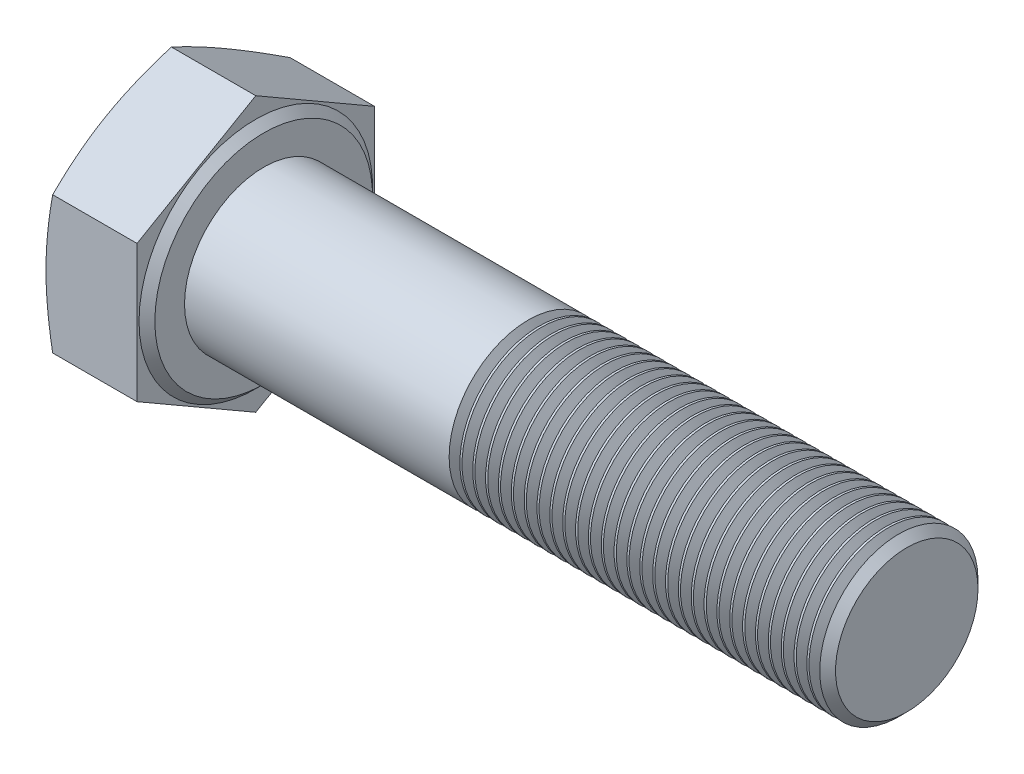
SolidWorks part; units mm, degrees
ref_plane "Front" through (0, 0, 0) normal (0, 0, 1) x (1, 0, 0)
ref_plane "Top" through (0, 0, 0) normal (0, 1, 0) x (1, 0, 0)
ref_plane "Right" through (0, 0, 0) normal (1, 0, 0) x (0, 0, -1)
other "Configuration Table"
sketch "Sketch2" plane through (0, 0, 0) normal (1, 0, 0) x (0, 0, -1)
  line L1 (0, -13.8564) -> (12, -6.9282)
  line L2 (12, -6.9282) -> (12, 6.9282)
  line L3 (12, 6.9282) -> (0, 13.8564)
  line L4 (0, 13.8564) -> (-12, 6.9282)
  line L5 (-12, 6.9282) -> (-12, -6.9282)
  line L6 (-12, -6.9282) -> (0, -13.8564)
  circle A0 centre (0, 0) radius 12 construction
extrude "BaseHead" add sketch "Sketch2" along normal blind 10
sketch "Sketch3" plane through (0, 0, 0) normal (0, 0, 1) x (1, 0, 0)
  line L0 (10, 13.8564) -> (10, 11)
  line L2 (10, 11) -> (9.2, 11.8)
  line L3 (9.2, 11.8) -> (9.2, 13.8564)
  line L5 (9.2, 13.8564) -> (10, 13.8564)
  line L6 (-0.9571, 0) -> (7.6478, 0) construction
  line L7 (10, 13.8564) -> (0, 13.8564) construction
  dimension "D1" = 45
  dimension "c" = 0.8
  dimension "dw" = 22
revolve "BearingFace" cut sketch "Sketch3" angle 360 about L6
sketch "Sketch4" plane through (0, 0, 0) normal (0, 0, 1) x (1, 0, 0)
  line L0 (-0.4935, 0) -> (3.5626, 0) construction
  line L2 (0, 13.8564) -> (0.6757, 13.8564)
  line L4 (0.6757, 13.8564) -> (0, 12)
  line L6 (0, 12) -> (0, 13.8564)
  line L7 (9.2, 13.8564) -> (0, 13.8564) construction
revolve "HeadChamfer" cut sketch "Sketch4" angle 360 about L0
ref_plane "Plane1" through (37, 0, 0) normal (1, 0, 0) x (0, 0, -1)
sketch "Sketch5" plane through (10, 0, 0) normal (1, 0, 0) x (0, 0, -1)
  circle A0 centre (0, 0) radius 8
extrude "BaseBody" add sketch "Sketch5" along normal blind 65
chamfer "Chamfer1" distance 0.8 angle 45 1 edges at (75, 0, -8)
fillet "HeadFillet" [suppressed] radius 0.6
sketch "Sketch6" plane through (0, 0, 0) normal (0, 0, 1) x (1, 0, 0)
  line L0 (73.1175, 9.0825) -> (74.2, 9.0825)
  line L1 (74.2, 9.0825) -> (74.2, 8)
  line L2 (74.2, 8) -> (73.6588, 7.0625)
  line L3 (73.6588, 7.0625) -> (73.1175, 8)
  line L4 (73.1175, 8) -> (73.1175, 9.0825)
  line L5 (74.2, -8) -> (74.2, 8) construction
  line L6 (74.2, 8) -> (10, 8) construction
revolve "Cut-Revolve10" cut sketch "Sketch6" angle 360 about axis through (75, 0, 0) along (-1, 0, 0)
pattern_linear "LPattern10" count 29 spacing 1.299 along (-1, 0, 0) of "Cut-Revolve10"
equation "\"D2@Sketch4\" = \"s@Sketch2\""
equation "\"D1@Chamfer1\" = 0.05 * \"d@Sketch5\""
equation "\"D1@ThreadCosmetic1\" = \"l@BaseBody\" - \"lg@Plane1\""
equation "\"D1@Sketch6\" =  ( \"d@Sketch5\" - \"D2@ThreadCosmetic1\" )  / 2"
equation "\"pitch@LPattern10\" = 1.2 * \"D1@Sketch6\""
equation "\"D1@LPattern10\" = \"D1@ThreadCosmetic1\" / \"pitch@LPattern10\""
